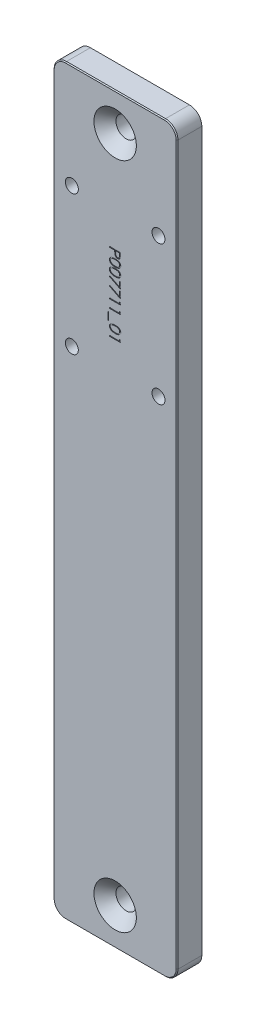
SolidWorks part; units mm, degrees
ref_plane "Ebene vorne" through (0, 0, 0) normal (0, 0, 1) x (1, 0, 0)
ref_plane "Ebene oben" through (0, 0, 0) normal (0, 1, 0) x (1, 0, 0)
ref_plane "Ebene rechts" through (0, 0, 0) normal (1, 0, 0) x (0, 0, -1)
sketch "Skizze2" plane through (0, 0, 0) normal (0, 0, 1) x (1, 0, 0)
  line L4 (-16, -140) -> (16, -140)
  line L5 (20, -136) -> (20, 96)
  line L6 (16, 100) -> (-16, 100)
  line L7 (-20, 96) -> (-20, -136)
  line L16 (0, 0) -> (0, 51.4989) construction
  line L17 (-14, 66.4) -> (14, 66.4) construction
  line L18 (-14, 66.4) -> (-14, 21.4) construction
  line L19 (-14, 21.4) -> (14, 21.4) construction
  line L20 (14, 66.4) -> (14, 21.4) construction
  line L21 (0, 0) -> (-103.9375, 0) construction
  circle A60 centre (0, 88) radius 3.3
  circle A71 centre (0, -128) radius 3.3
  arc A72 (16, -140) -> (20, -136) centre (16, -136) ccw
  arc A73 (20, 96) -> (16, 100) centre (16, 96) ccw
  arc A74 (-16, 100) -> (-20, 96) centre (-16, 96) ccw
  arc A75 (-20, -136) -> (-16, -140) centre (-16, -136) ccw
  circle A76 centre (14, 21.4) radius 0.5
  circle A77 centre (-14, 21.4) radius 0.5
  circle A78 centre (-14, 66.4) radius 0.5
  circle A79 centre (14, 66.4) radius 0.5
  circle A80 centre (0, 0) radius 10 construction
  dimension "D3" = 20
  dimension "D4" = 1
  dimension "D9" = 4
  dimension "D12" = 6.6
  dimension "D13" = 6.6
  dimension "D1" = 240
  dimension "D2" = 40
  dimension "D5" = 21.4
  dimension "D6" = 28
  dimension "D7" = 45
  dimension "D8" = 100
  dimension "D10" = 12
  dimension "D11" = 12
extrude "Aufsatz-Linear austragen1" add sketch "Skizze2" along normal blind 8
hole_wizard "M5 Gewindebohrung1" positions "Skizze3" profile "Skizze4" tap size "M5" standard "DIN"
sketch "Skizze3" plane through (0, 0, 8) normal (0, 0, 1) x (1, 0, 0)
  point P0 (-14, 21.4)
  point P3 (14, 21.4)
  point P6 (14, 66.4)
  point P9 (-14, 66.4)
sketch "Skizze4" plane through (-14, 21.4, 8) normal (1, 0, 0) x (0, -1, 0)
  line L0 (0, 0) -> (0, 15.2618)
  line L1 (0, 15.2618) -> (2.1, 14)
  line L2 (2.1, 14) -> (2.1, 0)
  line L5 (2.1, 0) -> (0, 0)
  line L10 (0, 15.2618) -> (-2.1, 14) construction
  line L11 (0, -6.35) -> (0, 107.95) construction
  dimension "Bohrerdurchmesser" = 4.2
  dimension "Bohrungstiefe" = 14
  dimension "Spitzenwinkel" = 118
hole_wizard "Formsenkung für M6 Senkschraube mit Innensechskant1" positions "Skizze5" profile "Skizze6" countersink size "M6" standard "DIN"
sketch "Skizze5" plane through (0, 0, 8) normal (0, 0, 1) x (1, 0, 0)
  point P0 (0, 88)
  point P3 (0, -128)
sketch "Skizze6" plane through (0, 88, 8) normal (1, 0, 0) x (0, -1, 0)
  line L0 (0, 0) -> (0, 13.4828)
  line L1 (0, 13.4828) -> (3.3, 11.5)
  line L2 (3.3, 11.5) -> (3.3, 3.555)
  line L3 (3.3, 3.555) -> (6.855, 0)
  line L5 (6.855, 0) -> (0, 0)
  line L6 (-3.3, 3.555) -> (-6.855, 0) construction
  line L10 (0, 13.4828) -> (-3.3, 11.5) construction
  line L11 (0, -6.35) -> (0, 107.95) construction
  dimension "Bohrerdurchmesser" = 6.6
  dimension "Bohrungstiefe" = 11.5
  dimension "Senkdurchmesser (Oben)" = 13.71
  dimension "Senkwinkel (Oben)" = 90
  dimension "Spitzenwinkel" = 118
chamfer "Fase1" distance 0.3 angle 45 8 edges at (20, -20, 8) (18.8284, 98.8284, 8) (18.8284, -138.8284, 8) (0, 100, 8) (0, -140, 8) (-18.8284, 98.8284, 8) (-18.8284, -138.8284, 8) (-20, -20, 8)
sketch "Skizze7" plane through (0, 0, 8) normal (0, 0, 1) x (1, 0, 0)
  line L0 (-1.75, 56) -> (-1.75, 28.2614) construction
  line L1 (-20, -136) -> (-20, 96) construction
  line L2 (-16, 100) -> (16, 100) construction
  text T0 "P007711_01"
  point P5 (-1.75, 42.9051)
  dimension "D1" = 18.25
  dimension "D2" = 44
extrude "Beschriftung" cut sketch "Skizze7" against normal blind 0.2
